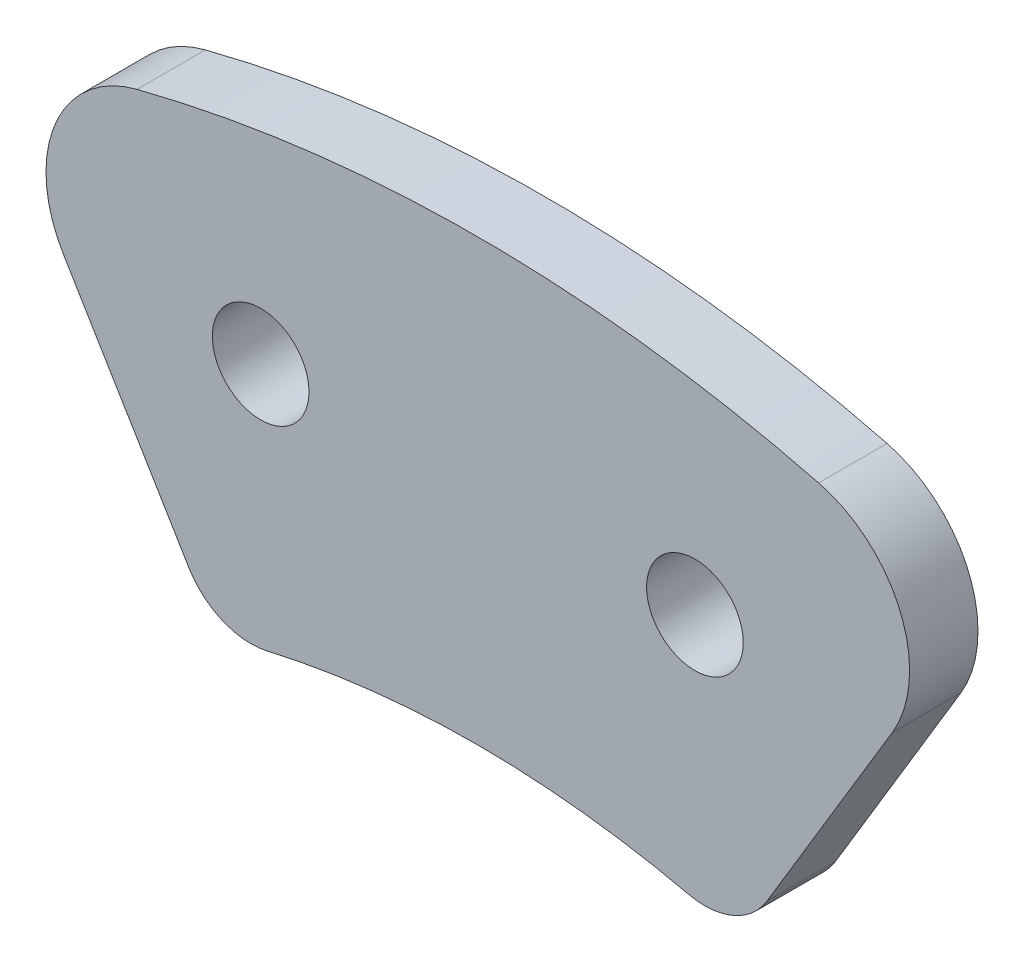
SolidWorks part; units mm, degrees
ref_plane "前视基准面" through (0, 0, 0) normal (0, 0, 1) x (1, 0, 0)
ref_plane "上视基准面" through (0, 0, 0) normal (0, 1, 0) x (1, 0, 0)
ref_plane "右视基准面" through (0, 0, 0) normal (1, 0, 0) x (0, 0, -1)
sketch "草图1" plane through (0, 0, 0) normal (0, 0, 1) x (1, 0, 0)
  line L0 (-4.7625, 25.4771) -> (-8.3344, 25.4771) construction
  line L1 (0, 0) -> (0, 17) construction
  line L2 (-4.7625, 25.4771) -> (4.7625, 25.4771) construction
  line L3 (0, 17) -> (0, 32.8717) construction
  line L4 (0, 10.2734) -> (-10.8185, 28.2784) construction
  line L5 (0, 10.2734) -> (8.3001, 24.0872) construction
  line L6 (0, 32.8717) -> (2.7877, 14.9129) construction
  line L7 (0, 32.8717) -> (-2.7877, 14.9129) construction
  line L8 (0, 0) -> (-4.7625, 25.4771) construction
  line L9 (0, 0) -> (4.7625, 25.4771) construction
  line L10 (4.7625, 25.4771) -> (19.0427, 25.4771) construction
  line L11 (1.8128, 20.5433) -> (5.7307, 19.8109)
  line L12 (0, 0) -> (13.5, 0) construction
  line L13 (13.5, 0) -> (15, 0) construction
  line L14 (-12.0194, 30.2771) -> (12.0194, 30.2771) construction
  line L15 (-10.8185, 28.2784) -> (-12.0194, 30.2771) construction
  line L16 (8.3001, 24.0872) -> (12.0194, 30.2771) construction
  line L17 (-1.8128, 20.5433) -> (-5.7307, 19.8109)
  circle A0 centre (0, 0) radius 25.9184
  circle A1 centre (0, 0) radius 25.4771
  arc A2 (-5.7307, 19.8109) -> (5.7307, 19.8109) centre (0, 0) cw
  circle A3 centre (-4.7625, 25.4771) radius 3.5719
  circle A4 centre (4.7625, 25.4771) radius 3.5719
  circle A6 centre (0, 0) radius 30.2771
  circle A7 centre (-4.7625, 25.4771) radius 1.06
  circle A8 centre (4.7625, 25.4771) radius 1.06
  point P21 (3.7718, 20.1771)
  dimension "d" = 51.8369
  dimension "da" = 50.9542
  dimension "D2" = 2.12
  dimension "p" = 9.525
  dimension "Z" = 17
  dimension "rd" = 3.5719
  dimension "α" = 62
  dimension "γ" = 8.824
  dimension "φ" = 21.176
  dimension "β" = 19.412
  dimension "b" = 13.5
  dimension "δ" = 1.5
  dimension "H" = 10.1
  dimension "h1" = 5.3
sketch "草图2" plane through (0, 0, 0) normal (0, 0, 1) x (1, 0, 0)
  line L2 (0, 10.2734) -> (8.3001, 24.0872) construction
  line L5 (0, 10.2734) -> (-10.8185, 28.2784) construction
  line L8 (5.7307, 19.8109) -> (8.3001, 24.0872)
  line L11 (-5.7307, 19.8109) -> (-10.8185, 28.2784)
  line L12 (8.3001, 24.0872) -> (12.0194, 30.2771) construction
  line L13 (8.3001, 24.0872) -> (10.8185, 28.2784)
  circle A0 centre (-4.7625, 25.4771) radius 1.06 construction
  circle A1 centre (4.7625, 25.4771) radius 1.06 construction
  circle A2 centre (0, 0) radius 30.2771 construction
  circle A3 centre (-4.7625, 25.4771) radius 1.06
  circle A4 centre (4.7625, 25.4771) radius 1.06
  arc A5 (10.8185, 28.2784) -> (-10.8185, 28.2784) centre (0, 0) ccw
  arc A6 (5.7307, 19.8109) -> (-5.7307, 19.8109) centre (0, 0) ccw construction
  arc A7 (5.7307, 19.8109) -> (-5.7307, 19.8109) centre (0, 0) ccw
extrude "拉伸1" add sketch "草图2" along normal mid plane 1.5
fillet "圆角1" radius 2.65 2 edges at (10.8185, 28.2784, 0) (-10.8185, 28.2784, 0)
fillet "圆角2" radius 1.59 2 edges at (-5.7307, 19.8109, 0) (5.7307, 19.8109, 0)
equation "\"d@草图1\" = \"p@草图1\" /  sin( 180 / \"Z@草图1\" ) "
equation "\"da@草图1\" = \"p@草图1\" /  tan( 180 / \"Z@草图1\" ) "
equation "\"rd@草图1\" = 0.375 * \"p@草图1\""
equation "\"γ@草图1\" = 30 - 360 / \"Z@草图1\""
equation "\"φ@草图1\" = 360 / \"Z@草图1\""
equation "\"D1@拉伸1\" = \"δ@草图1\""
equation "\"D1@圆角1\" = \"h1@草图1\" / 2"
equation "\"D1@圆角2\" = \"D1@圆角1\" * 0.6"
equation "\"D2@草图1\" = \"D1@圆角1\"  * 0.8"
